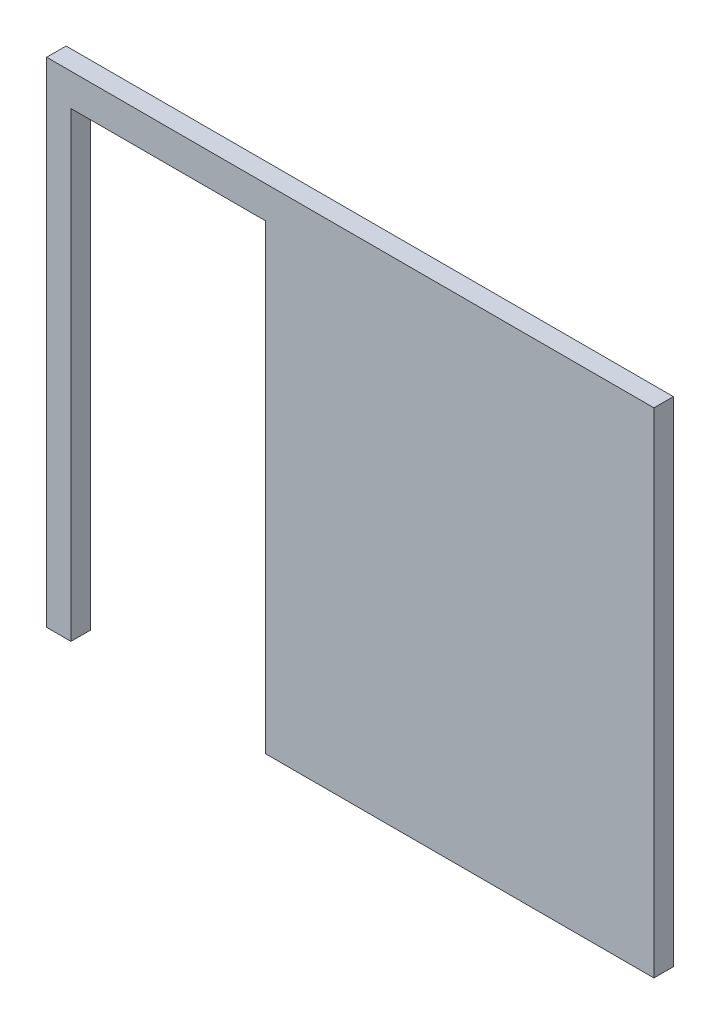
SolidWorks part; units mm, degrees
ref_plane "Alzado" through (0, 0, 0) normal (0, 0, 1) x (1, 0, 0)
ref_plane "Planta" through (0, 0, 0) normal (0, 1, 0) x (1, 0, 0)
ref_plane "Vista lateral" through (0, 0, 0) normal (1, 0, 0) x (0, 0, -1)
sketch "Croquis1" plane through (0, 0, 0) normal (0, 0, 1) x (1, 0, 0)
  line L0 (-181.5124, -1712.2194) -> (-281.5124, -1712.2194)
  line L1 (2218.4876, -1712.2194) -> (618.4876, -1712.2194)
  line L2 (2218.4876, -1712.2194) -> (2218.4876, 320.5906)
  line L3 (2218.4876, 320.5906) -> (-281.5124, 320.5906)
  line L4 (-281.5124, -1712.2194) -> (-281.5124, 320.5906)
  line L6 (-181.5124, -1712.2194) -> (-181.5124, 187.7806)
  line L7 (-181.5124, 187.7806) -> (618.4876, 187.7806)
  line L8 (618.4876, -1712.2194) -> (618.4876, 187.7806)
  dimension "D1" = 2032.81
  dimension "D2" = 2500
  dimension "D3" = 1900
  dimension "D4" = 800
  dimension "D5" = 100
extrude "Saliente-Extruir2" add sketch "Croquis1" along normal blind 80
